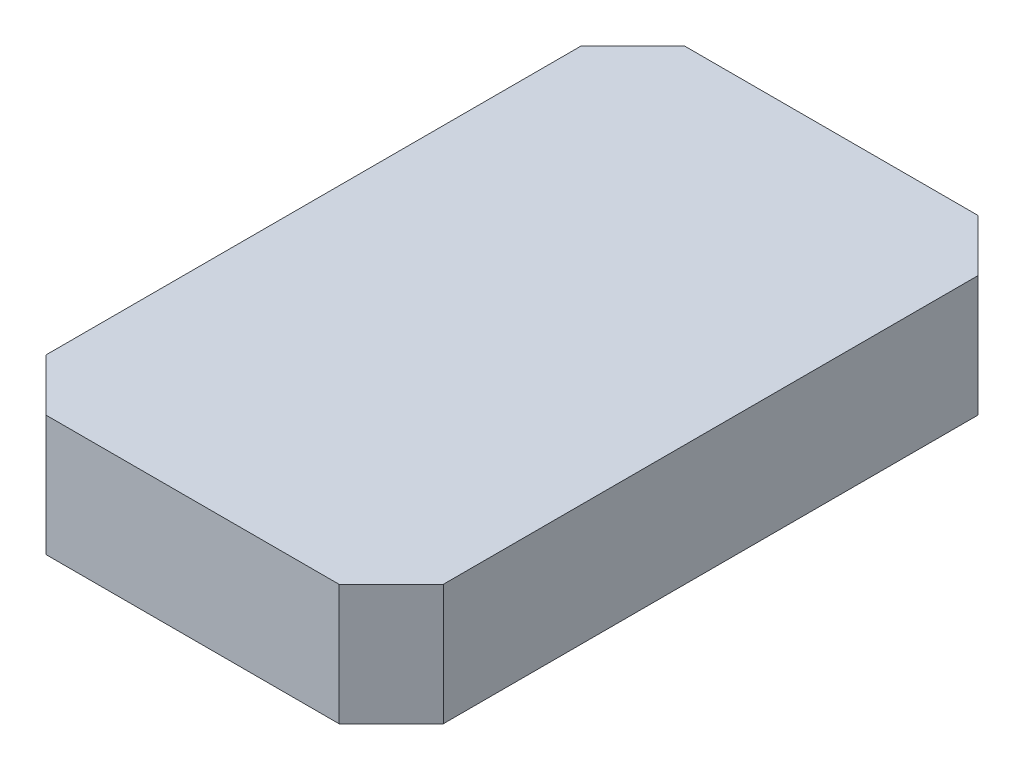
SolidWorks part; units mm, degrees
ref_plane "Front Plane" through (0, 0, 0) normal (0, 0, 1) x (1, 0, 0)
ref_plane "Top Plane" through (0, 0, 0) normal (0, 1, 0) x (1, 0, 0)
ref_plane "Right Plane" through (0, 0, 0) normal (1, 0, 0) x (0, 0, -1)
sketch "Sketch2" plane through (0, 0, 0) normal (0, 1, 0) x (1, 0, 0)
  line L8 (5.4586, 15.9) -> (-5.4586, 15.9)
  line L9 (-5.4586, 15.9) -> (-7.4, 13.9586)
  line L10 (-7.4, 13.9586) -> (-7.4, -5.9586)
  line L11 (-5.4586, -7.9) -> (-7.4, -5.9586)
  line L12 (5.4586, -7.9) -> (-5.4586, -7.9)
  line L13 (7.4, -5.9586) -> (5.4586, -7.9)
  line L14 (7.4, 13.9586) -> (7.4, -5.9586)
  line L15 (5.4586, 15.9) -> (7.4, 13.9586)
  point P4 (-5.5, 16)
  point P5 (-5.5, -8)
  point P6 (5.5, 16)
  point P7 (5.5, -8)
extrude "Boss-Extrude1" add sketch "Sketch2" along normal blind 4.5
